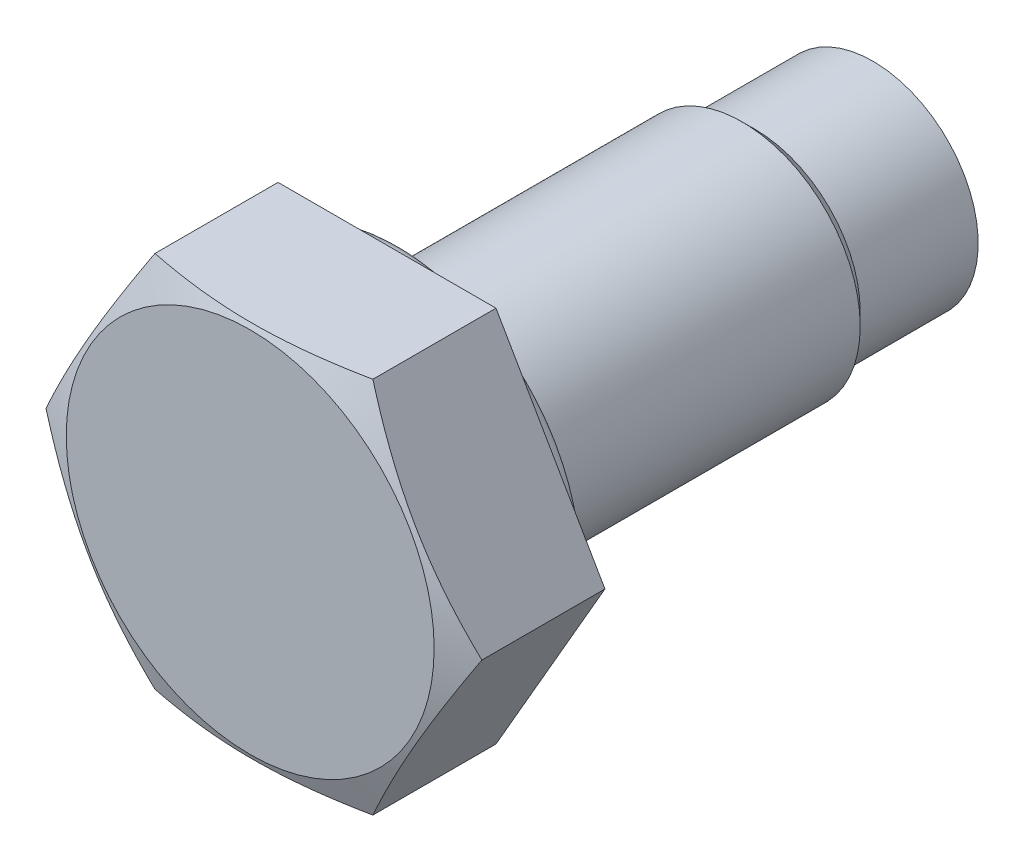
SolidWorks part; units mm, degrees
ref_plane "Plan1" through (0, 0, 0) normal (0, 0, 1) x (1, 0, 0)
ref_plane "Plan2" through (0, 0, 0) normal (0, 1, 0) x (1, 0, 0)
ref_plane "Plan3" through (0, 0, 0) normal (1, 0, 0) x (0, 0, -1)
imported_body "19 - Vis à métaux - Tête hexagonale - Tige normale ISO 8765 - M10x14 - 5,6"
sketch "Esquisse1" plane through (0, 0, -15) normal (0, 0, -1) x (-1, 0, 0)
  circle A1 centre (0, 0) radius 4.4588
  circle A2 centre (0, 0) radius 4.4588
  dimension "D1" = 0
extrude "Boss.-Extru.1" add sketch "Esquisse1" along normal blind 5
